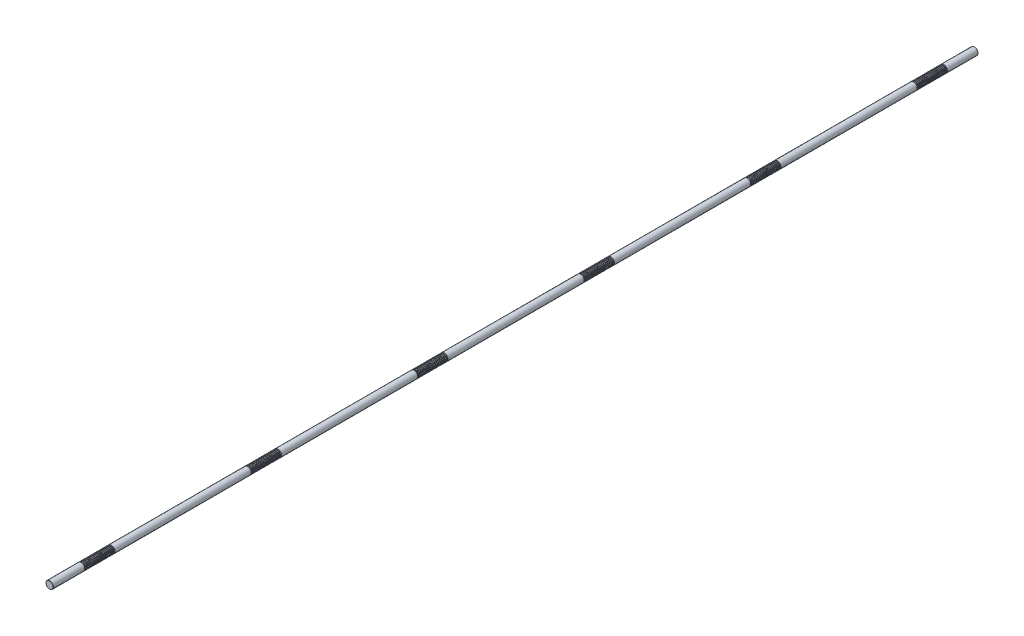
SolidWorks part; units mm, degrees
ref_plane "Front Plane" through (0, 0, 0) normal (0, 0, 1) x (1, 0, 0)
ref_plane "Top Plane" through (0, 0, 0) normal (0, 1, 0) x (1, 0, 0)
ref_plane "Right Plane" through (0, 0, 0) normal (1, 0, 0) x (0, 0, -1)
sketch "Sketch1" plane through (0, 0, 0) normal (0, 0, 1) x (1, 0, 0)
  circle A0 centre (0, 0) radius 12
  dimension "D1" = 24
extrude "Boss-Extrude1" add sketch "Sketch1" along normal mid plane 3000
chamfer "Chamfer1" distance 0.6 angle 45 2 edges at (12, 0, -1500) (12, 0, 1500)
sketch "Sketch2" plane through (0, 0, 0) normal (1, 0, 0) x (0, 0, -1)
  line L0 (1400.3684, 12) -> (1397.1316, 12)
  line L1 (1499.4, 12) -> (-1499.4, 12) construction
  line L2 (1397.1316, 12) -> (1397.8684, 9.25)
  line L3 (1397.8684, 9.25) -> (1399.6316, 9.25)
  line L4 (1399.6316, 9.25) -> (1400.3684, 12)
  line L5 (1500, -11.4) -> (1500, 11.4) construction
  point P4 (1398.75, 12)
  point P7 (1398.75, 9.25)
  point P8 (1400, 10.625)
  point P9 (1397.5, 10.625)
  dimension "D1" = 2.5
  dimension "D2" = 100
  dimension "D3" = 2.75
  dimension "D4" = 30
revolve "Cut-Revolve1" cut sketch "Sketch2" angle 360 about axis through (0, 0, 1500) along (0, 0, -1)
pattern_linear "LPattern1" count 20 spacing 5 along (0, 0, 1) of "Cut-Revolve1"
pattern_linear "LPattern2" count 6 spacing 540 along (0, 0, 1) of "Cut-Revolve1", "LPattern1"
